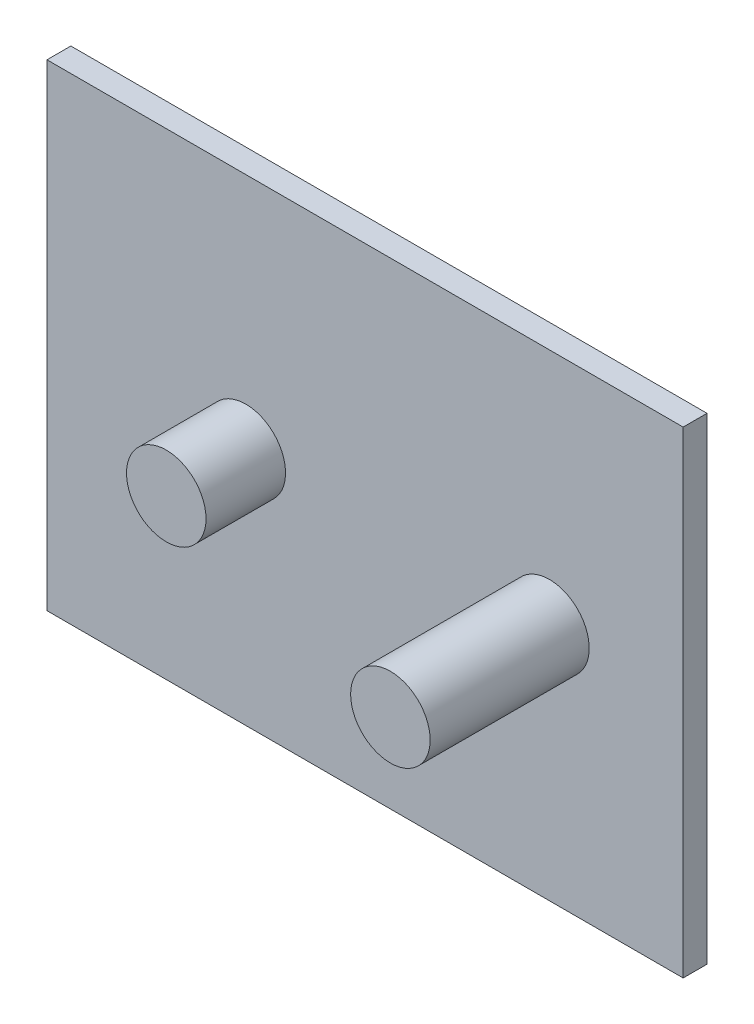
SolidWorks part; units mm, degrees
ref_plane "Plan de face" through (0, 0, 0) normal (0, 0, 1) x (1, 0, 0)
ref_plane "Plan de dessus" through (0, 0, 0) normal (0, 1, 0) x (1, 0, 0)
ref_plane "Plan de droite" through (0, 0, 0) normal (1, 0, 0) x (0, 0, -1)
sketch "Esquisse1" plane through (0, 0, 0) normal (0, 0, 1) x (1, 0, 0)
  line L1 (0, 0) -> (80, 0)
  line L2 (0, 0) -> (0, 60)
  line L3 (0, 60) -> (80, 60)
  line L4 (80, 0) -> (80, 60)
  dimension "D1" = 80
  dimension "D2" = 60
extrude "Extrusion1" add sketch "Esquisse1" along normal blind 3
sketch "Esquisse2" plane through (0, 0, 3) normal (0, 0, 1) x (1, 0, 0)
  line L0 (0, 30) -> (80, 30) construction
  line L1 (0, 60) -> (0, 0) construction
  line L2 (80, 0) -> (80, 60) construction
  line L3 (25, 47.5796) -> (25, -6.4701) construction
  circle A0 centre (25, 30) radius 5
  dimension "D2" = 10
  dimension "D1" = 25
extrude "Extrusion2" add sketch "Esquisse2" along normal blind 10
sketch "Esquisse3" plane through (0, 0, 3) normal (0, 0, 1) x (1, 0, 0)
  line L0 (0, 30) -> (80, 30) construction
  line L1 (0, 60) -> (0, 0) construction
  line L2 (80, 0) -> (80, 60) construction
  line L3 (25, -9.6402) -> (25, 45.2021) construction
  line L4 (25, 47.5796) -> (25, -6.4701) construction
pattern_linear "Répétition linéaire1" count 2 spacing 38.1838 along (1, 0, 0) of "Extrusion2"
sketch "Esquisse4" plane through (0, 0, 13) normal (0, 0, 1) x (1, 0, 0)
  circle A0 centre (63.1838, 30) radius 5 construction
  circle A1 centre (63.1838, 30) radius 5
extrude "Extrusion3" add sketch "Esquisse4" along normal blind 10
